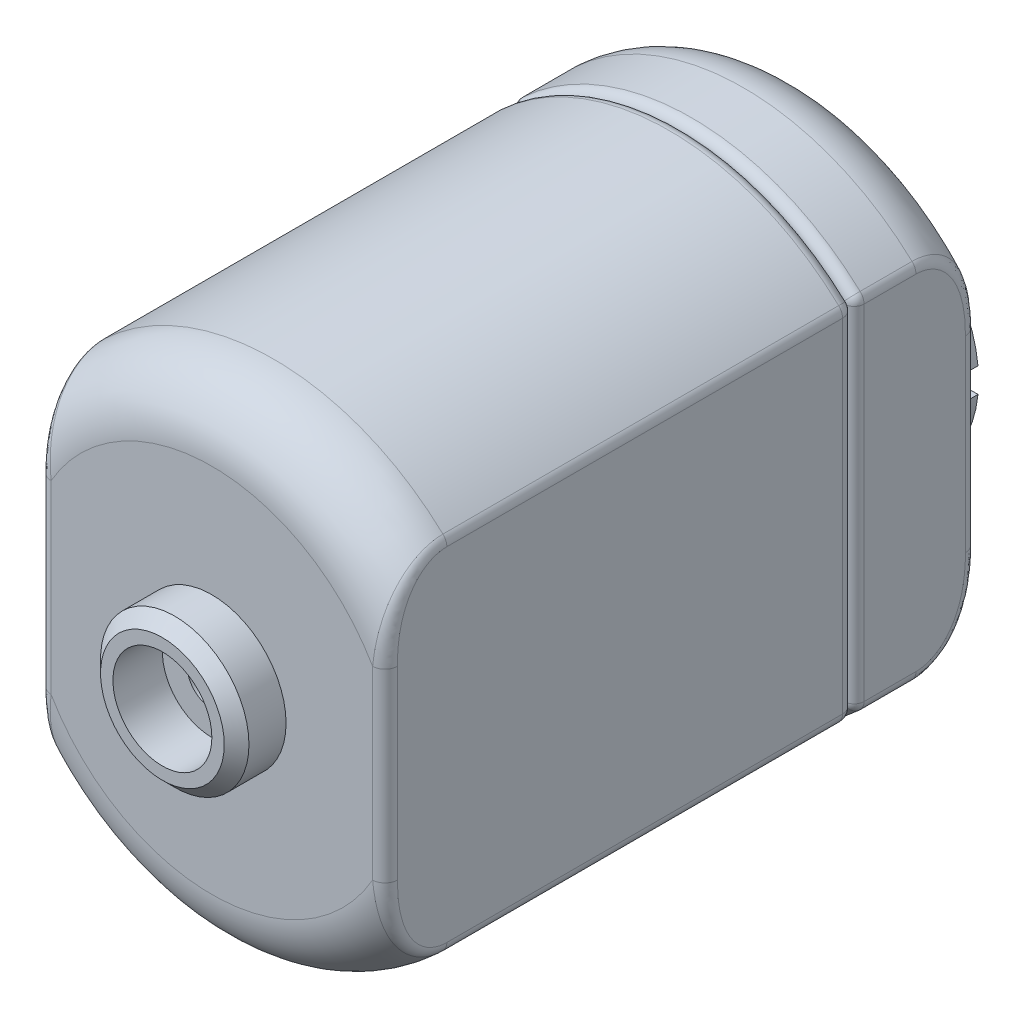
SolidWorks part; units mm, degrees
ref_plane "Plan1" through (0, 0, 0) normal (0, 0, 1) x (1, 0, 0)
ref_plane "Plan2" through (0, 0, 0) normal (0, 1, 0) x (1, 0, 0)
ref_plane "Plan3" through (0, 0, 0) normal (1, 0, 0) x (0, 0, -1)
sketch "Esquisse1" plane through (0, 0, 0) normal (0, 0, 1) x (1, 0, 0)
  line L0 (-7, 7.1414) -> (-7, -7.1414)
  line L1 (7, 7.1414) -> (7, -7.1414)
  arc A0 (7, 7.1414) -> (-7, 7.1414) centre (0, 0) ccw
  arc A1 (-7, -7.1414) -> (7, -7.1414) centre (0, 0) ccw
  dimension "D1" = 20
  dimension "D2" = 7
  dimension "D3" = 14
extrude "Base-Extrusion" add sketch "Esquisse1" along normal blind 19
sketch "Esquisse3" plane through (0, 0, 19) normal (0, 0, 1) x (1, 0, 0)
  circle A0 centre (0, 0) radius 3
  dimension "D1" = 6
extrude "Boss.-Extru.2" add sketch "Esquisse3" along normal blind 2
chamfer "Chanfrein1" distance 0.5 angle 45 1 edges at (3, 0, 21)
sketch "Esquisse4" plane through (0, 0, 21) normal (0, 0, 1) x (1, 0, 0)
  circle A0 centre (0, 0) radius 2.5
  dimension "D1" = 5
fillet "Congé1" radius 2.5 2 edges at (0, 10, 19) (0, -10, 19)
fillet "Congé2" radius 0.5 10 edges at (7, 0, 19) (-7, 0, 19) (7, 7.1414, 8.25) (7, -7.1414, 8.25) (7, 6.6967, 17.7104) (7, -6.0018, 18.3136) (-7, -7.1414, 8.25) (-7, 7.1414, 8.25) (-7, 6.0018, 18.3136) (-7, -6.6967, 17.7104)
fillet "Congé3" radius 0.5 8 edges at (-7, 0, 0) (0, -10, 0) (0, 10, 0) (7, 0, 0) (6.9588, -7.1269, 0) (6.9588, 7.1269, 0) (-6.9588, -7.1269, 0) (-6.9588, 7.1269, 0)
sketch "Esquisse8" plane through (0, 0, 0) normal (0, 0, -1) x (-1, 0, 0)
  line L0 (-6.9679, 7.1728) -> (-6.9679, -7.1728)
  line L1 (6.9679, 7.1728) -> (6.9679, -7.1728)
  arc A0 (6.9679, 7.1728) -> (-6.9679, 7.1728) centre (0, 0) ccw
  arc A1 (-6.9679, -7.1728) -> (6.9679, -7.1728) centre (0, 0) ccw
extrude "Boss.-Extru.6" add sketch "Esquisse8" along normal blind 5
fillet "Congé4" radius 2.5 2 edges at (0, 10, -5) (0, -10, -5)
fillet "Congé5" radius 0.5 10 edges at (6.9679, 0, -5) (-6.9679, 0, -5) (6.9679, -7.1728, -1.25) (6.9679, 7.1728, -1.25) (6.9679, -6.7272, -3.7142) (6.9679, 6.0709, -4.2935) (-6.9679, 7.1728, -1.25) (-6.9679, -7.1728, -1.25) (-6.9679, -6.0709, -4.2935) (-6.9679, 6.7272, -3.7142)
fillet "Congé7" radius 0.4 8 edges at (6.9679, 0, 0) (0, 10, 0) (-6.9679, 0, 0) (0, -10, 0) (-6.9262, -7.158, 0) (-6.9262, 7.158, 0) (6.9262, -7.158, 0) (6.9262, 7.158, 0)
sketch "Esquisse9" plane through (0, 0, -5) normal (0, 0, -1) x (-1, 0, 0)
  line L0 (3.5, 3.5707) -> (3.5, -3.5707)
  line L1 (0, 0) -> (-8.5, 0) construction
  line L2 (-4.9749, 0.5) -> (-4.5, 0.5)
  line L3 (-4.9749, -0.5) -> (-4.4, -0.5)
  line L4 (-4, 0) -> (-4, -0.1)
  line L5 (-2.9, 3.2) -> (-2.9, -3.1)
  line L6 (-2.7, 3.2) -> (-2.7, -3.1)
  line L7 (-2.7, -3.1) -> (-2.9, -3.1)
  line L8 (-2.9, 3.2) -> (-2.7, 3.2)
  arc A0 (3.5, 3.5707) -> (-4.9749, 0.5) centre (0, 0) ccw
  arc A1 (-4, 0) -> (-4.5, 0.5) centre (-4.5, 0) ccw
  arc A2 (-4.4, -0.5) -> (-4, -0.1) centre (-4.4, -0.1) ccw
  arc A3 (-4.9749, -0.5) -> (3.5, -3.5707) centre (0, 0) ccw
  dimension "D1" = 10
  dimension "D6" = 0.5
  dimension "D7" = 0.4
  dimension "D2" = 3.5
  dimension "D3" = 0.5
  dimension "D4" = 0.5
  dimension "D5" = 4
extrude "Boss.-Extru.7" add sketch "Esquisse9" along normal blind 2
sketch "Esquisse10" plane through (0, 0, -7) normal (0, 0, -1) x (-1, 0, 0)
  circle A0 centre (0, 0) radius 1
  dimension "D1" = 2
extrude "Boss.-Extru.8" add sketch "Esquisse10" along normal blind 1
sketch "Esquisse11" plane through (0, 0, 21) normal (0, 0, 1) x (1, 0, 0)
  circle A0 centre (0, 0) radius 1
  dimension "D1" = 2
extrude "Enlèv. mat.-Extru.3" cut sketch "Esquisse11" against normal through all
sketch "Esquisse12" plane through (0, 0, 21) normal (0, 0, 1) x (1, 0, 0)
  circle A0 centre (0, 0) radius 2
  dimension "D1" = 4
extrude "Enlèv. mat.-Extru.4" cut sketch "Esquisse12" against normal up to surface (2 mm away)
